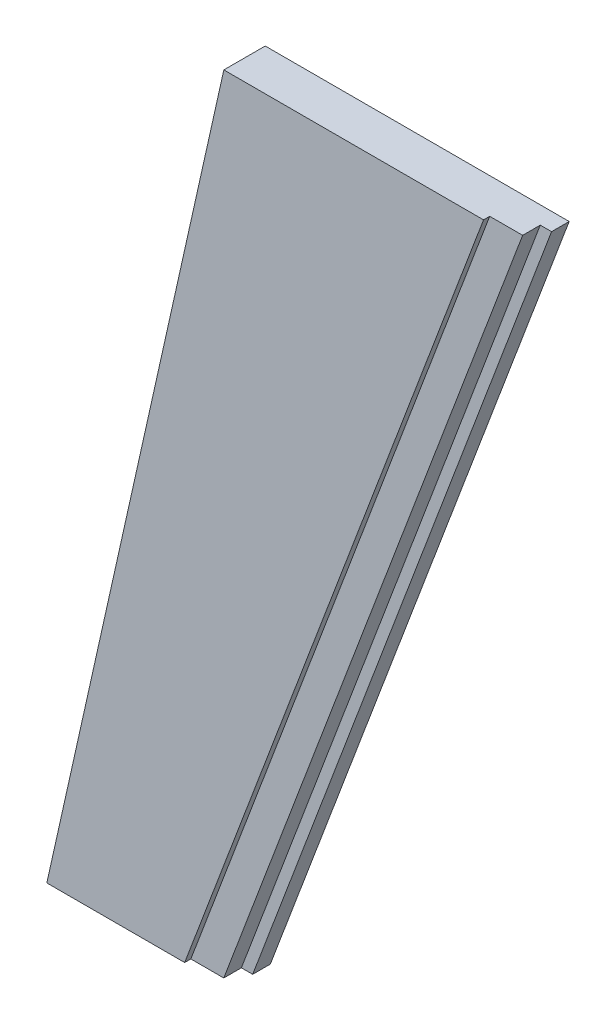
SolidWorks part; units mm, degrees
ref_plane "Спереди" through (0, 0, 0) normal (0, 0, 1) x (1, 0, 0)
ref_plane "Сверху" through (0, 0, 0) normal (0, 1, 0) x (1, 0, 0)
ref_plane "Справа" through (0, 0, 0) normal (1, 0, 0) x (0, 0, -1)
sketch "Эскиз1" plane through (0, 0, 0) normal (0, 0, 1) x (1, 0, 0)
  line L5 (-931.8468, 0) -> (-1226.7384, 0)
  line L6 (-1427.7191, -900) -> (-1271.2097, -900)
  line L20 (-931.8468, 0) -> (-1271.2097, -900)
  line L22 (-1226.7384, 0) -> (-1427.7191, -900)
extrude "Вытянуть1" add sketch "Эскиз1" along normal blind 47
sketch "Эскиз2" plane through (0, 0, 0) normal (0, 0, -1) x (-1, 0, 0)
  line L0 (931.8468, 0) -> (894.4413, 0)
  line L1 (1271.2097, -900) -> (1233.8041, -900)
  line L2 (1233.8041, -900) -> (894.4413, 0)
  line L3 (1271.2097, -900) -> (931.8468, 0) construction
  line L8 (931.8468, 0) -> (1271.2097, -900)
  line L9 (1271.2097, -900) -> (1427.7191, -900)
  line L10 (1427.7191, -900) -> (1226.7384, 0)
  line L11 (1226.7384, 0) -> (931.8468, 0)
  line L12 (931.8468, 0) -> (1271.2097, -900)
  dimension "D1" = 35
  dimension "D2" = 0
extrude "Вытянуть2" add sketch "Эскиз2" against normal blind 40
sketch "Эскиз3" plane through (0, 0, 0) normal (0, 0, -1) x (-1, 0, 0)
  line L0 (894.4413, 0) -> (881.6166, 0)
  line L1 (1233.8041, -900) -> (1220.9794, -900)
  line L2 (1220.9794, -900) -> (881.6166, 0)
  line L3 (894.4413, 0) -> (1233.8041, -900) construction
  line L8 (1226.7384, 0) -> (894.4413, 0)
  line L9 (894.4413, 0) -> (1233.8041, -900)
  line L10 (1233.8041, -900) -> (1427.7191, -900)
  line L11 (1427.7191, -900) -> (1226.7384, 0)
  line L13 (894.4413, 0) -> (1233.8041, -900)
  dimension "D1" = 12
  dimension "D2" = 0
extrude "Вытянуть3" add sketch "Эскиз3" against normal blind 20
